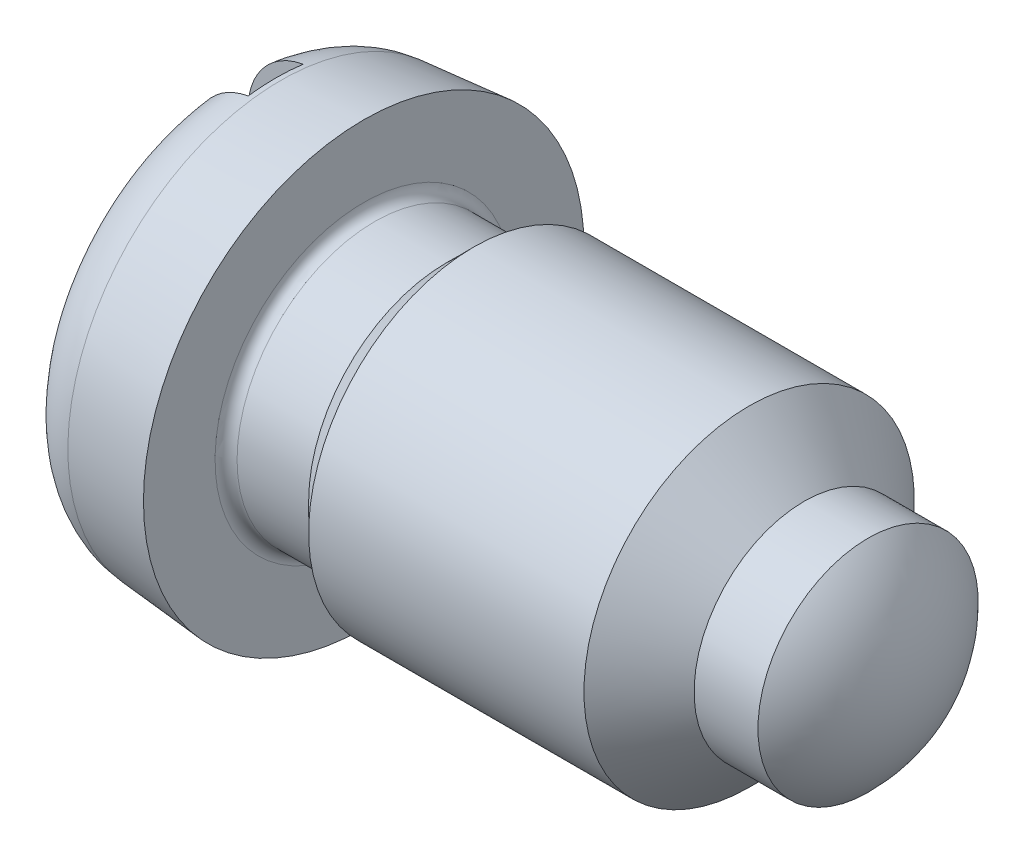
SolidWorks part; units mm, degrees
ref_plane "Front" through (0, 0, 0) normal (0, 0, 1) x (1, 0, 0)
ref_plane "Top" through (0, 0, 0) normal (0, 1, 0) x (1, 0, 0)
ref_plane "Right" through (0, 0, 0) normal (1, 0, 0) x (0, 0, -1)
sketch "Sketch1" plane through (0, 0, 0) normal (0, 0, 1) x (1, 0, 0)
  line L0 (1.3, 1.5) -> (4.8, 1.5)
  line L1 (4.8, 1.5) -> (5.3, 1)
  line L2 (5.3, 1) -> (5.8798, 1)
  line L3 (1.3, 0) -> (7.8489, 0) construction
  line L4 (1.3, 1.5) -> (1.3, 2)
  line L5 (1.3, 2) -> (0, 1.8863)
  line L6 (0, 0) -> (0, 1.8863)
  line L7 (6.3, 0) -> (0, 0)
  arc A0 (5.8798, 1) -> (6.3, 0) centre (4.9, 0) cw
  dimension "re" = 1.4
  dimension "d" = 3
  dimension "l" = 4
  dimension "D3" = 135
  dimension "dp" = 2
  dimension "z" = 1
  dimension "D7" = 5
  dimension "k" = 1.3
  dimension "dk" = 4
revolve "Base" add sketch "Sketch1" angle 360 about L3
fillet "Fillet1" radius 0.6 1 edges at (0, -1.8863, 0)
sketch "Sketch3" plane through (0, 0, 0) normal (0, 0, 1) x (1, 0, 0)
  line L0 (1.3, 2) -> (1.3, 1.25)
  line L1 (1.3, -2) -> (1.3, 2) construction
  line L2 (1.3, 1.5) -> (4.8, 1.5) construction
  line L3 (2.3, 1.5) -> (2.3, 2)
  line L4 (2.3, 2) -> (1.3, 2)
  line L5 (0, 0) -> (2.9582, 0) construction
  line L6 (0, 1.3365) -> (0, -1.3365) construction
  line L7 (6.3, 0) -> (0, 0) construction
  line L8 (2.3, 1.5) -> (2.05, 1.25)
  line L9 (2.05, 1.25) -> (1.3, 1.25)
  dimension "a" = 1
  dimension "D2" = 45
  dimension "D3" = 2.5
revolve "Cut-Revolve1" cut sketch "Sketch3" angle 360 about L5
fillet "Fillet2" radius 0.1 1 edges at (1.3, -1.25, 0)
sketch "Sketch2" plane through (0, 0, 0) normal (0, -1, 0) x (-1, 0, 0)
  line L0 (-1.6311, 0) -> (0.8061, 0) construction
  line L3 (0, -0.25) -> (-0.5, -0.25)
  line L4 (0, -0.25) -> (0, 0.25)
  line L5 (0, 0.25) -> (-0.5, 0.25)
  line L6 (-0.5, -0.25) -> (-0.5, 0.25)
  dimension "n" = 0.5
  dimension "t" = 0.5
extrude "Slot" cut sketch "Sketch2" against normal through all and the other way through all
sketch "Sketch4" plane through (0, 0, 0) normal (0, 0, 1) x (1, 0, 0)
  line L0 (4.8, 1.067) -> (5.05, 1.5)
  line L1 (5.05, 1.5) -> (5.05, 2)
  line L2 (5.05, 2) -> (4.55, 2)
  line L3 (4.55, 2) -> (4.55, 1.5)
  line L4 (4.55, 1.5) -> (4.8, 1.067)
  line L5 (4.8, -1.5) -> (4.8, 1.5) construction
  line L6 (4.8, 1.5) -> (2.3, 1.5) construction
  line L7 (0, 0) -> (8.3043, 0) construction
  line L8 (0, 1.3129) -> (0, -1.3129) construction
  dimension "D1" = 0.5
revolve "Cut-Revolve10" [suppressed] cut sketch "Sketch4" angle 360 about L7
pattern_linear "LPattern10" [suppressed] count 5 spacing 0.6 along (1, 0, 0)
equation "\"D3@Sketch3\" =  ( \"d@Sketch1\" + \"D2@ThreadCosmetic1\" )  / 2"
equation "\"D1@Sketch4\" =  ( \"d@Sketch1\" - \"D2@ThreadCosmetic1\" )  / 2"
equation "\"D3@LPattern10\" = \"D1@Sketch4\" * 1.2"
equation "\"D1@LPattern10\" =  ( \"l@Sketch1\" - \"a@Sketch3\" )  / \"D3@LPattern10\""
